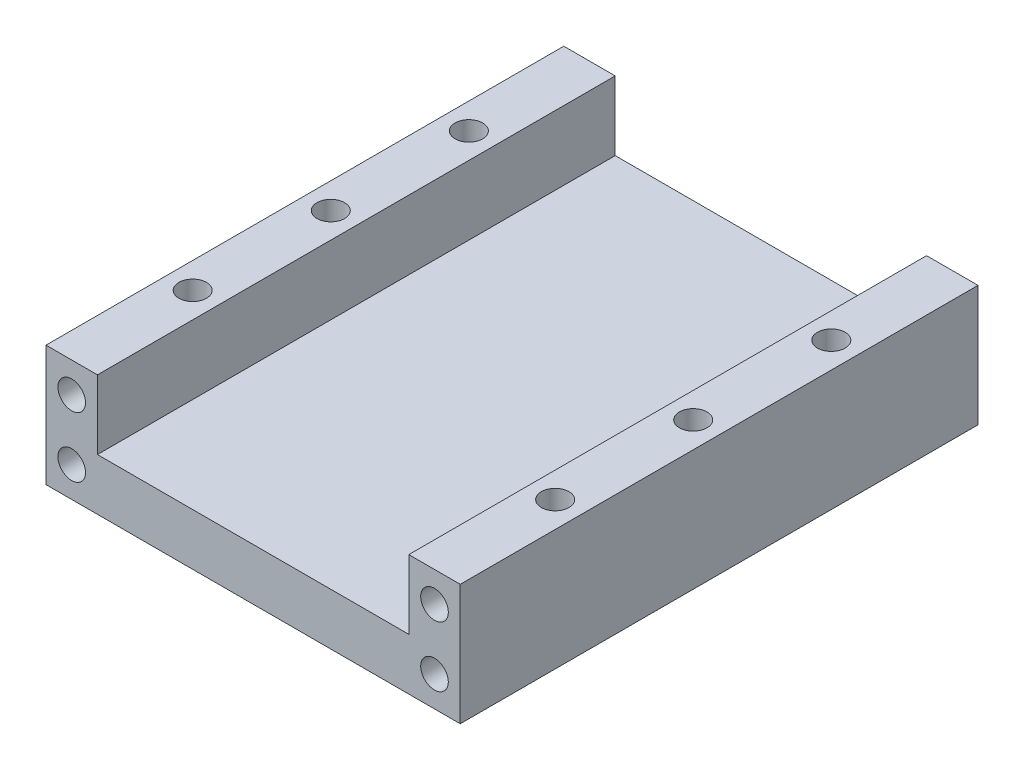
SolidWorks part; units mm, degrees
ref_plane "Front Plane" through (0, 0, 0) normal (0, 0, 1) x (1, 0, 0)
ref_plane "Top Plane" through (0, 0, 0) normal (0, 1, 0) x (1, 0, 0)
ref_plane "Right Plane" through (0, 0, 0) normal (1, 0, 0) x (0, 0, -1)
sketch "Sketch1" plane through (0, 0, 0) normal (0, 0, 1) x (1, 0, 0)
  line L0 (-60, 0) -> (60, 0)
  line L1 (60, 0) -> (60, 14.058)
  line L2 (60, 14.058) -> (60, 35)
  line L3 (60, 35) -> (45, 35)
  line L4 (45, 35) -> (45, 15)
  line L5 (45, 15) -> (-45, 15)
  line L7 (-45, 35) -> (-45, 15)
  line L8 (-60, 35) -> (-45, 35)
  line L9 (-60, 14.058) -> (-60, 35)
  line L10 (-60, 0) -> (-60, 14.058)
  dimension "D1" = 20
  dimension "D2" = 35
  dimension "D4" = 20
extrude "Boss-Extrude1" add sketch "Sketch1" along normal blind 150
hole_wizard "Ø8.0 (8) Diameter Hole1" positions "Sketch3" profile "Sketch5" hole size "Ø8.0" standard "ISO"
sketch "Sketch3" plane through (0, 35, 0) normal (0, 1, 0) x (1, 0, 0)
  line L0 (-52.5, 0) -> (-52.5, -150) construction
  line L1 (-45, 0) -> (-60, 0) construction
  line L2 (-45, -150) -> (-60, -150) construction
  line L4 (52.5, 0) -> (52.5, -150) construction
  line L5 (60, 0) -> (45, 0) construction
  line L6 (60, -150) -> (45, -150) construction
  point P0 (-52.5, -35)
  point P2 (-52.5, -75)
  point P4 (-52.5, -115)
  point P6 (52.5, -115)
  point P8 (52.5, -75)
  point P10 (52.5, -35)
  point P29 (-52.5, -75)
  point P31 (52.5, -75)
  dimension "D1" = 40
  dimension "D2" = 40
  dimension "D3" = 40
  dimension "D4" = 40
sketch "Sketch5" plane through (-52.5, 35, 35) normal (1, 0, 0) x (0, 0, 1)
  line L0 (0, 0) -> (0, 17.4034)
  line L1 (0, 17.4034) -> (4, 15)
  line L2 (4, 15) -> (4, 0)
  line L5 (4, 0) -> (0, 0)
  line L10 (0, 17.4034) -> (-4, 15) construction
  line L11 (0, -6.35) -> (0, 107.95) construction
  dimension "Hole Dia." = 8
  dimension "Hole Depth" = 15
  dimension "Drill Angle" = 118
sketch "Sketch6" plane through (0, 0, 150) normal (0, 0, 1) x (1, 0, 0)
  line L0 (60, 35) -> (45, 35) construction
  line L1 (45, 15) -> (45.1, 15)
  line L2 (45, 15) -> (45, 35)
  line L3 (45, 35) -> (45.1, 35)
  line L4 (45.1, 15) -> (45.1, 35)
  line L5 (-45, 35) -> (-60, 35) construction
  line L6 (-45, 15) -> (-45.1, 15)
  line L7 (-45, 15) -> (-45, 35)
  line L8 (-45, 35) -> (-45.1, 35)
  line L9 (-45.1, 15) -> (-45.1, 35)
  dimension "D1" = 0.1
  dimension "D2" = 0.1
extrude "Cut-Extrude1" cut sketch "Sketch6" against normal blind 164
sketch "Sketch7" plane through (0, 0, 150) normal (0, 0, 1) x (1, 0, 0)
  line L5 (0, 0) -> (0, 40.6257)
  line L6 (-60, 0) -> (60, 0) construction
  circle A0 centre (-52.55, 26.25) radius 4
  circle A1 centre (-52.55, 8.75) radius 4
  circle A2 centre (52.55, 8.75) radius 4
  circle A3 centre (52.55, 26.25) radius 4
  dimension "D1" = 8
  dimension "D2" = 8
hole_wizard "Ø8.0mm Dowel Hole1" positions "3DSketch1" profile "Sketch8" hole size "Ø8.0" standard "ISO"
sketch3d "3DSketch1"
  point P0 (-52.55, 26.25, 150)
  point P3 (-52.55, 8.75, 150)
  point P6 (52.55, 8.75, 150)
  point P9 (52.55, 26.25, 150)
sketch "Sketch8" plane through (-52.55, 26.25, 150) normal (1, 0, 0) x (0, -1, 0)
  line L0 (0, 0) -> (0, 17.4034)
  line L1 (0, 17.4034) -> (4, 15)
  line L2 (4, 15) -> (4, 0)
  line L5 (4, 0) -> (0, 0)
  line L10 (0, 17.4034) -> (-4, 15) construction
  line L11 (0, -6.35) -> (0, 107.95) construction
  dimension "Hole Dia." = 8
  dimension "Hole Depth" = 15
  dimension "Drill Angle" = 118
sketch "Sketch9" plane through (0, 0, 0) normal (0, -1, 0) x (1, 0, 0)
  line L0 (-52.55, 150) -> (-52.55, 0) construction
  line L1 (-48.55, 150) -> (-56.55, 150) construction
  line L2 (-60, 0) -> (60, 0) construction
  line L3 (52.55, 150) -> (52.55, 0) construction
  line L4 (56.55, 150) -> (48.55, 150) construction
  circle A0 centre (-52.5, 115) radius 4
  circle A1 centre (-52.5, 35) radius 4
  circle A2 centre (52.5, 35) radius 4
  circle A3 centre (52.5, 115) radius 4
hole_wizard "Ø8.0mm Dowel Hole3" positions "3DSketch3" profile "Sketch12" hole size "Ø8.0" standard "ISO"
sketch3d "3DSketch3"
  line L0 (-52.55, 0, 150) -> (-52.55, 0, 0) construction
  line L1 (52.55, 0, 150) -> (52.55, 0, 0) construction
  point P0 (-52.55, 0, 15)
  point P4 (-52.55, 0, 125)
  point P6 (52.55, 0, 15)
  point P10 (52.55, 0, 125)
  point P14 (-52.55, 0, 75)
  point P18 (52.55, 0, 75)
  dimension "D1" = 60
  dimension "D2" = 60
  dimension "D3" = 50
  dimension "D5" = 50
sketch "Sketch12" plane through (-52.55, 0, 15) normal (1, 0, 0) x (0, 0, -1)
  line L0 (0, 0) -> (0, 17.4034)
  line L1 (0, 17.4034) -> (4, 15)
  line L2 (4, 15) -> (4, 0)
  line L5 (4, 0) -> (0, 0)
  line L10 (0, 17.4034) -> (-4, 15) construction
  line L11 (0, -6.35) -> (0, 107.95) construction
  dimension "Hole Dia." = 8
  dimension "Hole Depth" = 15
  dimension "Drill Angle" = 118
sketch "Sketch13" plane through (0, 0, 0) normal (0, -1, 0) x (-1, 0, 0)
  line L1 (52.55, -125) -> (-52.55, -125)
  line L2 (52.55, -125) -> (52.55, -15)
  line L3 (52.55, -15) -> (-52.55, -15)
  line L4 (-52.55, -125) -> (-52.55, -15)
  dimension "D1" = 105.1
  dimension "D2" = 110
